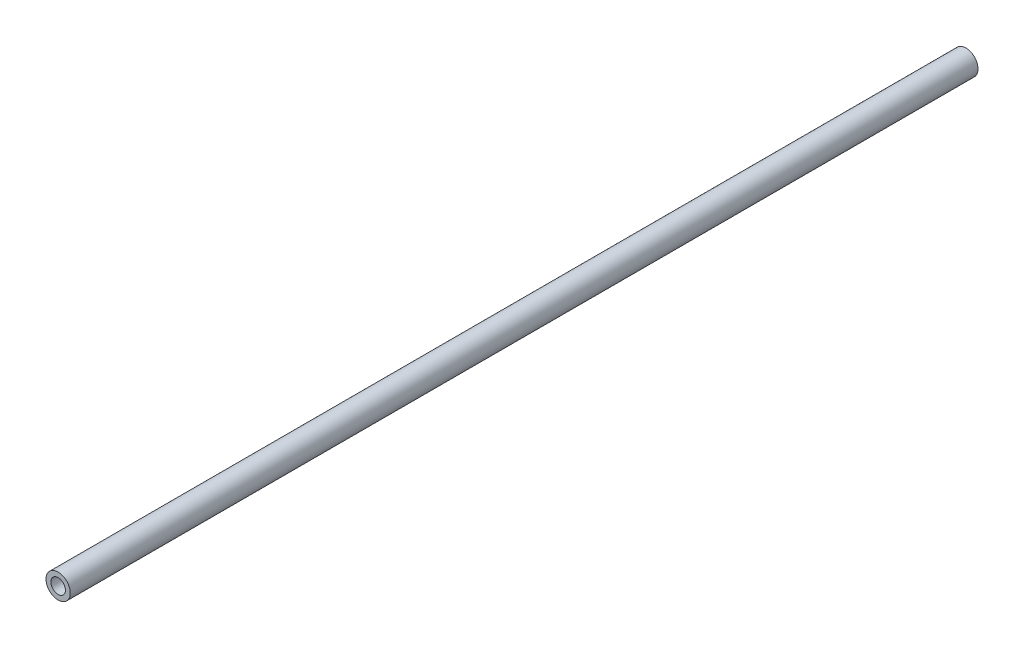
SolidWorks part; units mm, degrees
ref_plane "Front Plane" through (0, 0, 0) normal (0, 0, 1) x (1, 0, 0)
ref_plane "Top Plane" through (0, 0, 0) normal (0, 1, 0) x (1, 0, 0)
ref_plane "Right Plane" through (0, 0, 0) normal (1, 0, 0) x (0, 0, -1)
sketch "Sketch1" plane through (0, 0, 0) normal (0, 0, 1) x (1, 0, 0)
  circle A0 centre (0, 0) radius 6.35
  circle A1 centre (0, 0) radius 3.81
extrude "Extrude1" add sketch "Sketch1" along normal blind 474.98
